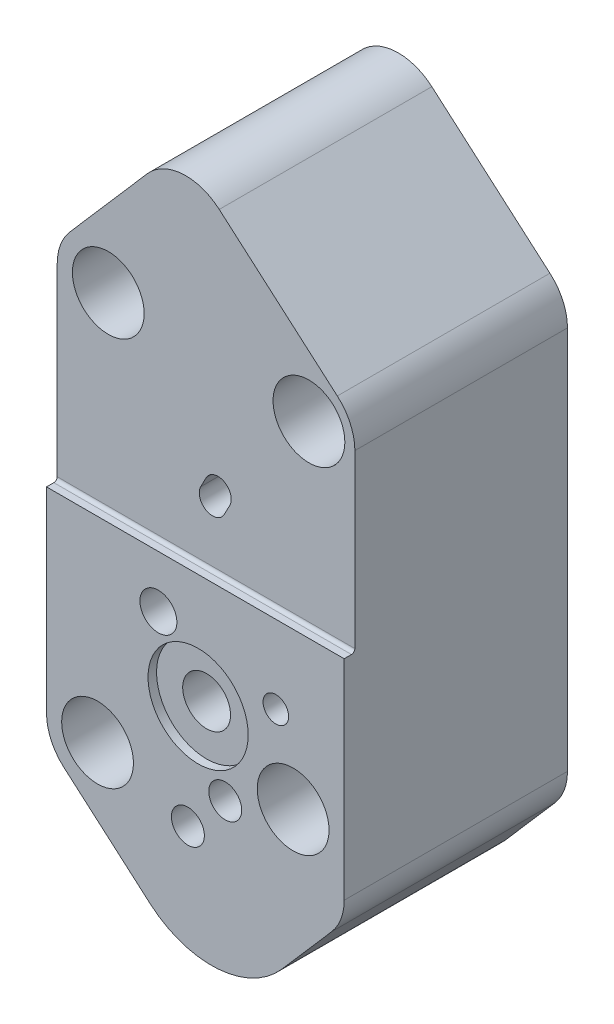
SolidWorks part; units mm, degrees
ref_plane "Front" through (0, 0, 0) normal (0, 0, 1) x (1, 0, 0)
ref_plane "Top" through (0, 0, 0) normal (0, 1, 0) x (1, 0, 0)
ref_plane "Right" through (0, 0, 0) normal (1, 0, 0) x (0, 0, -1)
ref_plane "Plane1"
sketch "Sketch1" plane through (0, 0, 0) normal (0, 0, 1) x (1, 0, 0)
  line L0 (-799.2745, 33.2628) -> (-781.6416, 17.9499)
  line L1 (-810.0242, 32.5058) -> (-821.6013, 19.1747)
  line L2 (-780.8847, -50.1533) -> (-788.2982, -58.69)
  line L3 (-820.8444, -48.9285) -> (-808.0059, -60.0778)
  line L4 (-827.6942, -72.3181) -> (-833.0797, -67.6412) construction
  line L5 (-827.6942, -72.3181) -> (-833.0797, -67.6412) construction
  line L7 (-823.468, 14.1783) -> (-823.468, -43.1752)
  line L8 (-779.018, 12.1965) -> (-779.018, -45.157)
  line L10 (-817.118, -85.471) -> (-817.118, 85.471) construction
  line L11 (-777.367, 0) -> (-817.118, 0) construction
  arc A0 (-823.468, -43.1752) -> (-820.8444, -48.9285) centre (-815.848, -43.1752) ccw
  arc A1 (-823.468, 14.1783) -> (-821.6013, 19.1747) centre (-815.848, 14.1783) cw
  arc A2 (-779.018, 12.1965) -> (-781.6416, 17.9499) centre (-786.638, 12.1965) ccw
  arc A3 (-780.8847, -50.1533) -> (-779.018, -45.157) centre (-786.638, -45.157) ccw
  arc A4 (-788.2982, -58.69) -> (-808.0059, -60.0778) centre (-798.8459, -49.53) cw
  arc A5 (-810.0242, 32.5058) -> (-799.2745, 33.2628) centre (-804.2709, 27.5094) cw
extrude "Boss-Extrude1" add sketch "Sketch1" against normal blind 31.75 and the other way blind 1.5999 flip side to cut
hole_wizard "Hole1" positions "Point_Sketch" profile "Profil_Sketch" legacy
sketch "Point_Sketch" plane through (-806.009, -36.6401, 1.5999) normal (0, 0, -1) x (1, 0, 0)
  point P0 (3.6543, 10.6011)
  point P2 (9.231, 4.5369)
sketch "Profil_Sketch" plane through (-802.3548, -47.2413, 1.5999) normal (1, 0, 0) x (0, -1, 0)
  line L0 (0, 0) -> (0, 33.3499)
  line L1 (0, 33.3499) -> (2.6943, 33.3499)
  line L2 (2.4587, 6.35) -> (2.4587, 0)
  line L3 (2.4587, 6.35) -> (2.6943, 33.3499)
  line L4 (2.4587, 0) -> (0, 0)
  line L7 (0, -4.2442) -> (0, 117.3081) construction
  dimension "Diameter" = 4.9174
  dimension "Depth" = 33.3499
  dimension "L1" = 6.35
  dimension "A1" = 0.5
other "usin_DS102<1>"
hole_wizard "Hole11" positions "Point_Sketch1" profile "Profil_Sketch1" legacy
sketch "Point_Sketch1" plane through (-792.875, -14.9521, 1.5999) normal (0, 0, -1) x (1, 0, 0)
  point P0 (3.6543, 10.6011)
sketch "Profil_Sketch1" plane through (-789.2208, -25.5532, 1.5999) normal (1, 0, 0) x (0, -1, 0)
  line L0 (0, 0) -> (0, 33.3499)
  line L1 (0, 33.3499) -> (2.1432, 33.3499)
  line L2 (1.9075, 6.35) -> (1.9075, 0)
  line L3 (1.9075, 6.35) -> (2.1432, 33.3499)
  line L4 (1.9075, 0) -> (0, 0)
  line L7 (0, -4.2442) -> (0, 117.3081) construction
  dimension "Diameter" = 3.8151
  dimension "Depth" = 33.3499
  dimension "L1" = 6.35
  dimension "A1" = 0.5
other "usin_DS102<2>"
hole_wizard "Hole12" positions "Point_Sketch2" profile "Profil_Sketch2" legacy
sketch "Point_Sketch2" plane through (-810.4146, -11.0849, 1.5999) normal (0, 0, -1) x (1, 0, 0)
  point P0 (3.6543, 10.6011)
sketch "Profil_Sketch2" plane through (-806.7604, -21.6861, 1.5999) normal (1, 0, 0) x (0, -1, 0)
  line L0 (0, 0) -> (0, 33.3499)
  line L1 (0, 33.3499) -> (2.9941, 33.3499)
  line L2 (2.7584, 6.35) -> (2.7584, 0)
  line L3 (2.7584, 6.35) -> (2.9941, 33.3499)
  line L4 (2.7584, 0) -> (0, 0)
  line L7 (0, -4.2442) -> (0, 117.3081) construction
  dimension "Diameter" = 5.5169
  dimension "Depth" = 33.3499
  dimension "L1" = 6.35
  dimension "A1" = 0.5
other "usin_DS102<3>"
hole_wizard "Hole13" positions "Point_Sketch3" profile "Profil_Sketch3" hole size "Ø0.15" standard "ISO"
sketch "Point_Sketch3" plane through (-803.5274, 6.4914, 1.5999) normal (0, 0, -1) x (1, 0, 0)
  point P0 (3.6543, 10.6011)
sketch "Profil_Sketch3" plane through (-799.8731, -4.1097, 1.5999) normal (1, 0, 0) x (0, -1, 0)
  line L0 (0, 0) -> (0, 33.3499)
  line L1 (0, 33.3499) -> (0.0005, 33.3499)
  line L2 (0.0005, 33.3499) -> (0.0005, 0)
  line L5 (0.0005, 0) -> (0, 0)
  line L11 (0, -6.35) -> (0, 107.95) construction
  dimension "Diameter" = 0.001
  dimension "Thru Hole Depth" = 33.3499
other "usin_DL090_o_DAYTON VERSATILE INCH VPO-50-2130-P0.1999-W0.1310 X2-0<1>"
ref_plane "Plane2"
sketch "Sketch10" plane through (0, 0, 1.5999) normal (0, 0, 1) x (1, 0, 0)
  line L2 (-798.5169, -5.8006) -> (-797.7099, -4.2477)
  line L3 (-801.2294, -2.4189) -> (-802.0363, -3.9717)
  line L4 (-798.5169, -5.8006) -> (-797.7099, -4.2477)
  line L5 (-801.2294, -2.4189) -> (-802.0363, -3.9717)
  arc A2 (-802.0363, -3.9717) -> (-798.5169, -5.8006) centre (-800.2766, -4.8861) ccw
  arc A3 (-797.7099, -4.2477) -> (-801.2294, -2.4189) centre (-799.4697, -3.3333) ccw
  arc A4 (-802.0363, -3.9717) -> (-798.5169, -5.8006) centre (-800.2766, -4.8861) ccw
  arc A5 (-797.7099, -4.2477) -> (-801.2294, -2.4189) centre (-799.4697, -3.3333) ccw
extrude "Cut-Extrude1" cut sketch "Sketch10" against normal through all draft 0.5 and the other way through all from offset 7.9499
sketch "Sketch11" plane through (0, 0, 1.5999) normal (0, 0, 1) x (1, 0, 0)
  circle A0 centre (-800.8298, -30.9504) radius 7.1746 construction
  circle A1 centre (-800.8298, -30.9504) radius 7.1746 construction
hole_wizard "Hole15" positions "Point_Sketch5" profile "Profil_Sketch5" legacy
sketch "Point_Sketch5" plane through (-804.4841, -20.3493, 1.5999) normal (0, 0, -1) x (1, 0, 0)
  point P0 (3.6543, 10.6011)
sketch "Profil_Sketch5" plane through (-800.8298, -30.9504, 1.5999) normal (1, 0, 0) x (0, -1, 0)
  line L0 (0, 0) -> (0, 33.3499) construction
  line L1 (0, 33.3499) -> (3.5719, 33.3499)
  line L2 (3.5719, 33.3499) -> (3.5719, 1.27)
  line L3 (3.5719, 1.27) -> (7.2231, 1.27)
  line L4 (7.2231, 0) -> (0, 0) construction
  line L5 (0, 33.3499) -> (0, -1)
  line L6 (-3.5719, 1.27) -> (-7.2231, 1.27) construction
  line L7 (0, -4.2442) -> (0, 117.3081) construction
  line L8 (0, -1) -> (7.2231, -1)
  line L9 (7.2231, -1) -> (7.2231, 1.27)
  dimension "Diameter" = 7.1437
  dimension "Depth" = 33.3499
  dimension "L1" = 1.27
  dimension "A1" = 180
  dimension "FixDim" = 1
other "usin_DS100<1>"
sketch "Sketch16" plane through (0, 0, 1.5999) normal (0, 0, 1) x (1, 0, 0)
  line L0 (-823.468, -13.9178) -> (-779.018, -13.9178)
  line L1 (-201630.0303, -7.5678) -> (248369.9697, -7.5678) construction
  line L6 (-820.8444, -48.9285) -> (-808.0059, -60.0778)
  line L7 (-788.2982, -58.69) -> (-780.8847, -50.1533)
  line L8 (-779.018, -45.157) -> (-779.018, 12.1965)
  line L9 (-781.6416, 17.9499) -> (-799.2745, 33.2628)
  line L10 (-810.0242, 32.5058) -> (-821.6013, 19.1747)
  line L11 (-823.468, 14.1783) -> (-823.468, -43.1752)
  line L14 (-779.018, -13.9178) -> (-779.018, 12.1965)
  line L15 (-781.6416, 17.9499) -> (-799.2745, 33.2628)
  line L16 (-810.0242, 32.5058) -> (-821.6013, 19.1747)
  line L17 (-823.468, 14.1783) -> (-823.468, -13.9178)
  arc A6 (-823.468, -43.1752) -> (-820.8444, -48.9285) centre (-815.848, -43.1752) ccw
  arc A7 (-808.0059, -60.0778) -> (-788.2982, -58.69) centre (-798.8459, -49.53) ccw
  arc A8 (-780.8847, -50.1533) -> (-779.018, -45.157) centre (-786.638, -45.157) ccw
  arc A9 (-779.018, 12.1965) -> (-781.6416, 17.9499) centre (-786.638, 12.1965) ccw
  arc A10 (-799.2745, 33.2628) -> (-810.0242, 32.5058) centre (-804.2709, 27.5094) ccw
  arc A11 (-821.6013, 19.1747) -> (-823.468, 14.1783) centre (-815.848, 14.1783) ccw
  arc A15 (-779.018, 12.1965) -> (-781.6416, 17.9499) centre (-786.638, 12.1965) ccw
  arc A16 (-799.2745, 33.2628) -> (-810.0242, 32.5058) centre (-804.2709, 27.5094) ccw
  arc A17 (-821.6013, 19.1747) -> (-823.468, 14.1783) centre (-815.848, 14.1783) ccw
  dimension "D2" = 6.35
  dimension "D1" = 0
extrude "Cut-Extrude3" cut sketch "Sketch16" against normal offset from surface (1.5999 mm away) 31.75
fillet "Fillet1" radius 0.508 1 edges at (-801.243, -13.9178, 0)
hole_wizard "Hole16" positions "Point_Sketch6" profile "Profil_Sketch6" counterbore size "1/4" standard "ANSI Inch"
sketch "Point_Sketch6" plane through (-828.7171, 15.1133, 0) normal (0, 0, -1) x (1, 0, 0)
  point P0 (12.8691, 0.935)
  point P2 (42.8411, 2.5693)
  point P4 (42.0791, 52.3328)
  point P6 (12.8691, 58.2885)
sketch "Profil_Sketch6" plane through (-815.848, 14.1783, 0) normal (1, 0, 0) x (0, -1, 0)
  line L0 (0, 0) -> (0, 31.75)
  line L1 (0, 31.75) -> (3.5687, 31.75)
  line L3 (3.5687, 31.75) -> (3.5687, 17.526)
  line L4 (3.5687, 17.526) -> (5.3594, 17.526)
  line L5 (5.3594, 17.526) -> (5.3594, 0)
  line L7 (5.3594, 0) -> (0, 0)
  line L11 (0, -6.35) -> (0, 107.95) construction
  dimension "Diameter" = 7.1374
  dimension "Thru Hole Depth" = 31.75
  dimension "L1" = 17.526
other "usin_LS160_.25-20x1.5-SHCS<1>"
sketch "Sketch19" plane through (0, 0, 0) normal (0, 0, -1) x (-1, 0, 0)
  circle A1 centre (815.848, -43.1752) radius 5.3594
  circle A2 centre (815.848, -43.1752) radius 5.3594
  circle A3 centre (786.638, -37.2195) radius 5.3594
  circle A4 centre (786.638, -37.2195) radius 5.3594
  dimension "D1" = 0
  dimension "D2" = 0
extrude "Cut-Extrude4" cut sketch "Sketch19" against normal through all
sketch "Sketch20" plane through (0, 0, -31.75) normal (0, 0, -1) x (-1, 0, 0)
  line L24 (806.9203, 65.1333) -> (730.2092, -1.4848)
  line L25 (806.9203, 65.1333) -> (873.5384, -11.5777)
  line L26 (730.2092, -1.4848) -> (796.8273, -78.1958)
  line L27 (873.5384, -11.5777) -> (796.8273, -78.1958)
  line L28 (781.6416, 17.9499) -> (799.2745, 33.2628) construction
  line L29 (810.0242, 32.5058) -> (821.6013, 19.1747) construction
  line L30 (788.2982, -58.69) -> (780.8847, -50.1533) construction
  line L31 (820.8444, -48.9285) -> (808.0059, -60.0778) construction
  dimension "D1" = 19.05
  dimension "D2" = 19.05
  dimension "D3" = 6.35
  dimension "D4" = 6.35
  dimension "D5" = 101.6
  dimension "D6" = 101.6
sketch "Sketch1 _Machining axis" plane through (0, 0, 1.5999) normal (0, 0, 1) x (1, 0, 0)
  line L0 (-779.018, -45.157) -> (-779.018, -13.9178) construction
  point P0 (-773.938, -18.9978)
sketch "Sketch1 _Wire EDM" plane through (0, 0, 1.5999) normal (0, 0, 1) x (1, 0, 0)
  circle A0 centre (-773.938, -18.9978) radius 3.175
other "Move Face1" parameters "D1"=0.254
